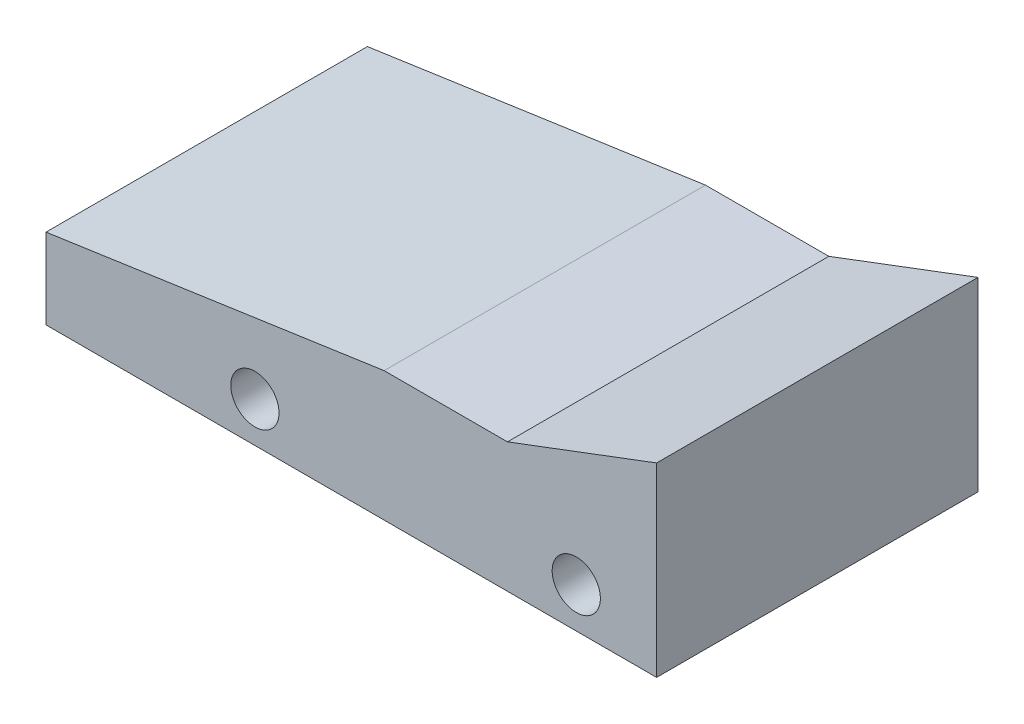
SolidWorks part; units mm, degrees
ref_plane "Front Plane" through (0, 0, 0) normal (0, 0, 1) x (1, 0, 0)
ref_plane "Top Plane" through (0, 0, 0) normal (0, 1, 0) x (1, 0, 0)
ref_plane "Right Plane" through (0, 0, 0) normal (1, 0, 0) x (0, 0, -1)
sketch "Sketch1" plane through (0, 0, 0) normal (0, 0, 1) x (1, 0, 0)
  line L0 (-34.4689, -13.6532) -> (930.7311, -13.6532)
  line L1 (-34.4689, -13.6532) -> (-34.4689, 113.3468)
  line L2 (930.7311, -13.6532) -> (930.7311, 279.9776)
  line L3 (930.7311, 279.9776) -> (694.9891, 190.9579)
  line L4 (694.9891, 190.9579) -> (499.9935, 190.9579)
  line L5 (499.9935, 190.9579) -> (-34.4689, 113.3468)
  circle A0 centre (295.7311, 49.8468) radius 38.1
  circle A1 centre (803.7311, 49.8468) radius 38.1
  dimension "D5" = 76.2
  dimension "D6" = 76.2
  dimension "D1" = 965.2
  dimension "D2" = 127
  dimension "D3" = 293.6308
  dimension "D4" = 194.9955
  dimension "D7" = 508
  dimension "D8" = 127
  dimension "D9" = 63.5
  dimension "D10" = 63.5
extrude "Boss-Extrude1" add sketch "Sketch1" along normal blind 508
sketch "Sketch2" plane through (0, 0, 508) normal (0, 0, 1) x (1, 0, 0)
